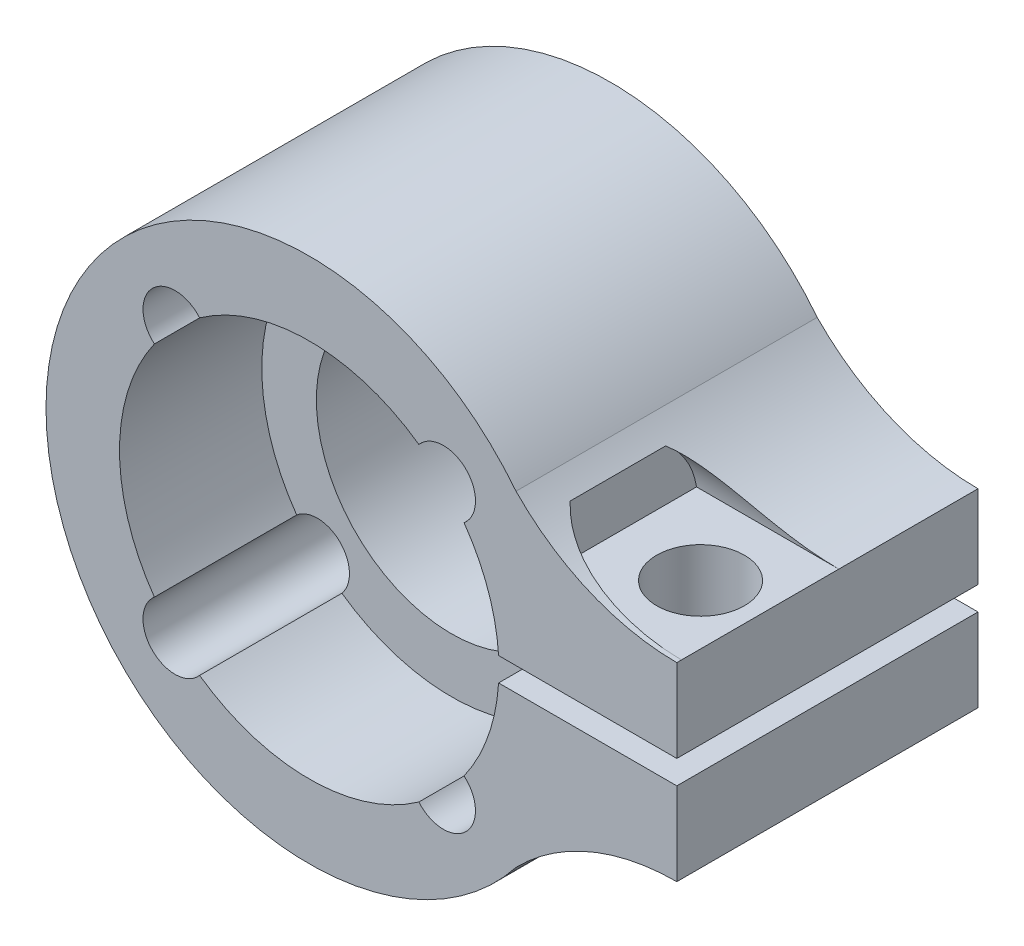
SolidWorks part; units mm, degrees
ref_plane "Front Plane" through (0, 0, 0) normal (0, 0, 1) x (1, 0, 0)
ref_plane "Top Plane" through (0, 0, 0) normal (0, 1, 0) x (1, 0, 0)
ref_plane "Right Plane" through (0, 0, 0) normal (1, 0, 0) x (0, 0, -1)
sketch "Sketch1" plane through (0, 0, 0) normal (0, 0, 1) x (1, 0, 0)
  line L0 (-18.136, 0) -> (24.0528, 0) construction
  line L1 (0, 0) -> (0, 0.5)
  line L2 (0, 0.5) -> (15.5, 0.5)
  line L3 (15.5, 0.5) -> (15.5, 4)
  line L5 (0, 0) -> (0, -0.5)
  line L6 (0, -0.5) -> (15.5, -0.5)
  line L7 (15.5, -0.5) -> (15.5, -4)
  arc A0 (8.7199, 6.8683) -> (8.7199, -6.8683) centre (0, 0) ccw
  arc A6 (15.5, 4) -> (8.7199, 6.8683) centre (15.5, 13.4476) cw
  arc A7 (15.5, -4) -> (8.7199, -6.8683) centre (15.5, -13.4476) ccw
  dimension "D1" = 22.2
  dimension "D3" = 0.5
  dimension "D4" = 0.5
  dimension "D5" = 3.5
  dimension "D6" = 3.5
  dimension "D7" = 15.5
  dimension "D8" = 15.5
extrude "Extrude1" add sketch "Sketch1" against normal blind 12.7
sketch "Sketch2" plane through (0, 0, 0) normal (0, 0, 1) x (1, 0, 0)
  circle A1 centre (5.6572, 5.6565) radius 1.85
  circle A2 centre (-5.6572, -5.6565) radius 1.85
  circle A3 centre (5.6565, -5.6572) radius 1.85
  circle A4 centre (-5.6565, 5.6572) radius 1.85
hole_wizard "#6-32 Tapped Hole3" positions "3DSketch3" profile "Sketch5" tap size "#6-32" standard "Ansi Inch"
sketch3d "3DSketch3"
  point P0 (-5.6565, 5.6572, 0)
  point P3 (5.6572, 5.6565, 0)
  point P6 (5.6565, -5.6572, 0)
  point P9 (-5.6572, -5.6565, 0)
sketch "Sketch5" plane through (-5.6565, 5.6572, 0) normal (1, 0, 0) x (0, -1, 0)
  line L0 (0, 0) -> (0, 12.7)
  line L1 (0, 12.7) -> (1.3525, 12.7)
  line L2 (1.3525, 12.7) -> (1.3525, 0)
  line L5 (1.3525, 0) -> (0, 0)
  line L11 (0, -6.35) -> (0, 107.95) construction
  dimension "Thru Tap Drill Dia." = 2.7051
  dimension "Thru Tap Drill Depth" = 12.7
sketch "Sketch8" plane through (0, 0, 0) normal (0, 0, 1) x (1, 0, 0)
  line L0 (3.9182, -0.5) -> (0, -0.5)
  line L1 (15.5, -0.5) -> (0, -0.5) construction
  line L2 (0, -0.5) -> (0, 0.5)
  line L3 (0, 0.5) -> (3.9182, 0.5)
  line L4 (0, 0.5) -> (15.5, 0.5) construction
  arc A0 (3.9182, 0.5) -> (3.9182, -0.5) centre (0, 0) ccw
  dimension "D1" = 7.9
extrude "Extrude3" [suppressed] add sketch "Sketch8" along normal blind 2.5
sketch "Sketch9" [suppressed] plane through (0, 0, 2.5) normal (0, 0, 1) x (1, 0, 0)
  circle A0 centre (0, 0) radius 2.45
  dimension "D1" = 4.9
extrude "Cut-Extrude3" [suppressed] cut sketch "Sketch9" against normal through all
sketch "Sketch14" plane through (0, 0.5, 0) normal (0, -1, 0) x (1, 0, 0)
  line L0 (15.5, -12.7) -> (15.5, 0) construction
  circle A0 centre (13, -3.5) radius 1.85
  dimension "D1" = 3.7
  dimension "D2" = 2.5
extrude "Cut-Extrude6" cut sketch "Sketch14" against normal through all
hole_wizard "#6-32 Tapped Hole5" positions "Sketch19" profile "Sketch18" tap size "#6-32" standard "Ansi Inch"
sketch "Sketch19" plane through (0, -0.5, 0) normal (0, 1, 0) x (-1, 0, 0)
  line L0 (-15.5, -12.7) -> (-15.5, 0) construction
  point P0 (-13, -3.5)
  dimension "D1" = 2.5
sketch "Sketch18" plane through (13, -0.5, -3.5) normal (1, 0, 0) x (0, 0, 1)
  line L0 (0, 0) -> (0, 51.6127)
  line L1 (0, 51.6127) -> (1.3525, 50.8)
  line L2 (1.3525, 50.8) -> (1.3525, 0)
  line L5 (1.3525, 0) -> (0, 0)
  line L10 (0, 51.6127) -> (-1.3526, 50.8) construction
  line L11 (0, -6.35) -> (0, 107.95) construction
  dimension "Tap Drill Dia." = 2.7051
  dimension "Tap Drill Depth" = 50.8
  dimension "Drill Angle" = 118
sketch "Sketch24" plane through (15.5, 0, 0) normal (1, 0, 0) x (0, 0, -1)
  line L1 (12.7, 4) -> (0, 4) construction
  line L2 (0.2, 4) -> (6.8323, 4)
  arc A0 (0.2, 4) -> (6.8323, 4) centre (3.5162, 3.4607) cw
  dimension "D2" = 0.2
extrude "Cut-Extrude26" cut sketch "Sketch24" against normal blind 6
sketch "Sketch25" plane through (0, 0, 0) normal (0, 0, 1) x (1, 0, 0)
  circle A0 centre (0, 0) radius 5.7
  dimension "D1" = 11.4
extrude "Cut-Extrude27" cut sketch "Sketch25" against normal through all
sketch "Sketch26" plane through (0, 0, 0) normal (0, 0, 1) x (1, 0, 0)
  circle A0 centre (0, 0) radius 8
  dimension "D1" = 16
extrude "Cut-Extrude28" cut sketch "Sketch26" against normal blind 6
